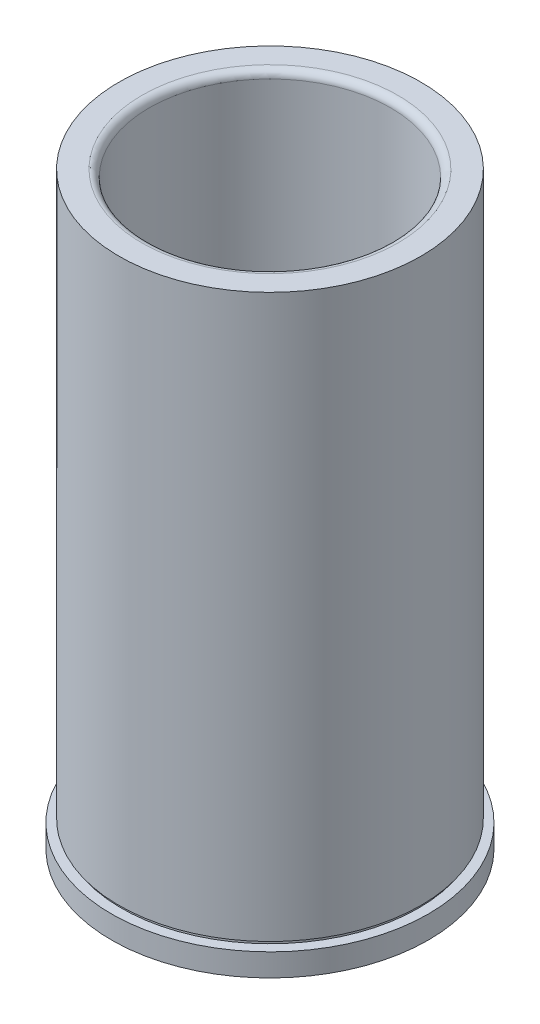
SolidWorks part; units mm, degrees
ref_plane "Front Plane" through (0, 0, 0) normal (0, 0, 1) x (1, 0, 0)
ref_plane "Top Plane" through (0, 0, 0) normal (0, 1, 0) x (1, 0, 0)
ref_plane "Right Plane" through (0, 0, 0) normal (1, 0, 0) x (0, 0, -1)
sketch "Sketch1" plane through (0, 0, 0) normal (0, 0, 1) x (1, 0, 0)
  line L0 (-911.3132, 0) -> (49088.6868, 0) construction
  line L1 (0, -1000) -> (0, 49000) construction
  line L2 (-25.4063, 123.825) -> (-25.4063, 22.225)
  line L4 (-33.3375, 0) -> (-33.3375, 4.7625)
  line L5 (-33.3375, 4.7625) -> (-31.2483, 4.7625)
  line L6 (-31.7564, 123.825) -> (-31.7563, 5.5245)
  line L7 (-31.7564, 123.825) -> (-25.4063, 123.825)
  line L8 (-26.6763, 20.955) -> (-26.6763, 1.27)
  line L9 (-26.6763, 1.27) -> (-27.9463, 0)
  line L10 (-31.7563, 5.5245) -> (-31.2483, 5.5245)
  line L11 (-31.2483, 5.5245) -> (-31.2483, 4.7625)
  line L12 (-27.9463, 0) -> (-33.3375, 0)
  arc A0 (-25.4063, 22.225) -> (-26.6763, 20.955) centre (-25.4063, 20.955) ccw
  dimension "D1" = 0.508
  dimension "OD" = 63.5127
  dimension "ID" = 50.8127
  dimension "FLANGETHICKNESS" = 4.7625
  dimension "FLANGEDIA" = 66.675
  dimension "D2" = 1.27
  dimension "D3" = 0.762
  dimension "D4" = 1.27
  dimension "D5" = 45
  dimension "D6" = 101.6
  dimension "D7" = 123.825
revolve "Revolve1" add sketch "Sketch1" angle 360 about L1
fillet "Fillet1" radius 1.524 1 edges at (25.4063, 123.825, 0)
